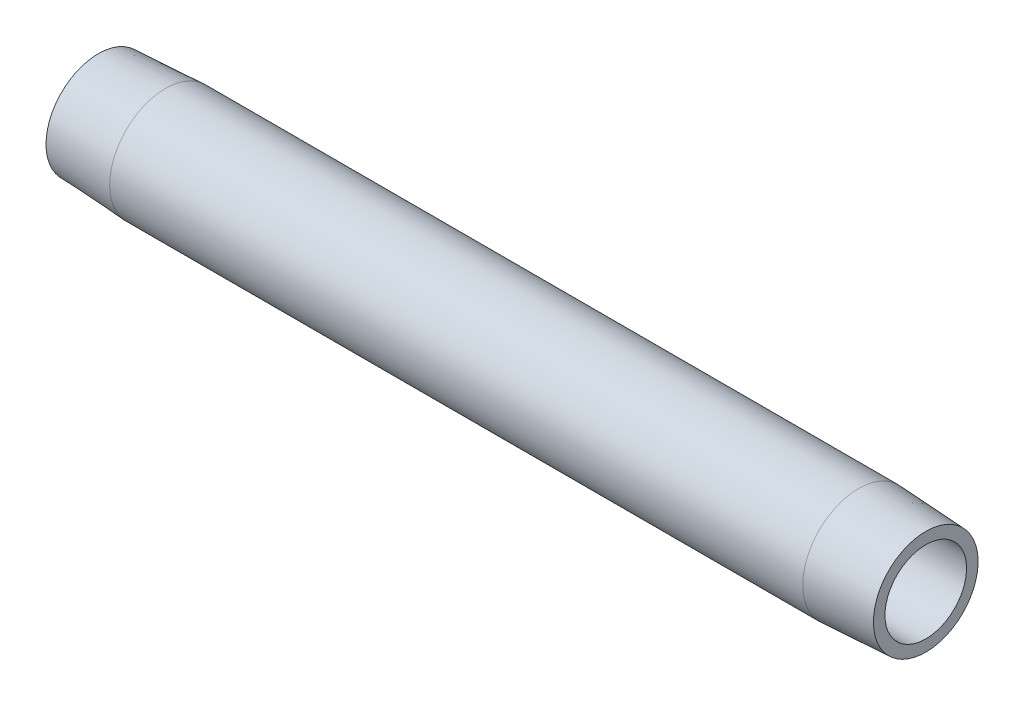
SolidWorks part; units mm, degrees
ref_plane "Front Plane" through (0, 0, 0) normal (0, 0, 1) x (1, 0, 0)
ref_plane "Top Plane" through (0, 0, 0) normal (0, 1, 0) x (1, 0, 0)
ref_plane "Right Plane" through (0, 0, 0) normal (1, 0, 0) x (0, 0, -1)
sketch "Sketch1" plane through (0, 0, 0) normal (0, 0, 1) x (1, 0, 0)
  line L5 (127, 6.2611) -> (0, 6.2611)
  line L6 (116.6876, 8.5725) -> (10.3124, 8.5725)
  line L7 (10.3124, 8.5725) -> (0, 8.0321)
  line L8 (127, 8.0321) -> (116.6876, 8.5725)
  line L9 (127, 6.2611) -> (127, 8.0321)
  line L10 (0, 6.2611) -> (0, 8.0321)
  line L11 (0, 0) -> (50000, 0) construction
  line L12 (0, -55) -> (0, 55) construction
  dimension "D1" = 12.5222
  dimension "D2" = 17.145
  dimension "D3" = 3
  dimension "D4" = 3
  dimension "D5" = 127
  dimension "D6" = 10.3124
  dimension "D7" = 10.3124
revolve "Revolve1" add sketch "Sketch1" angle 360 about L11
